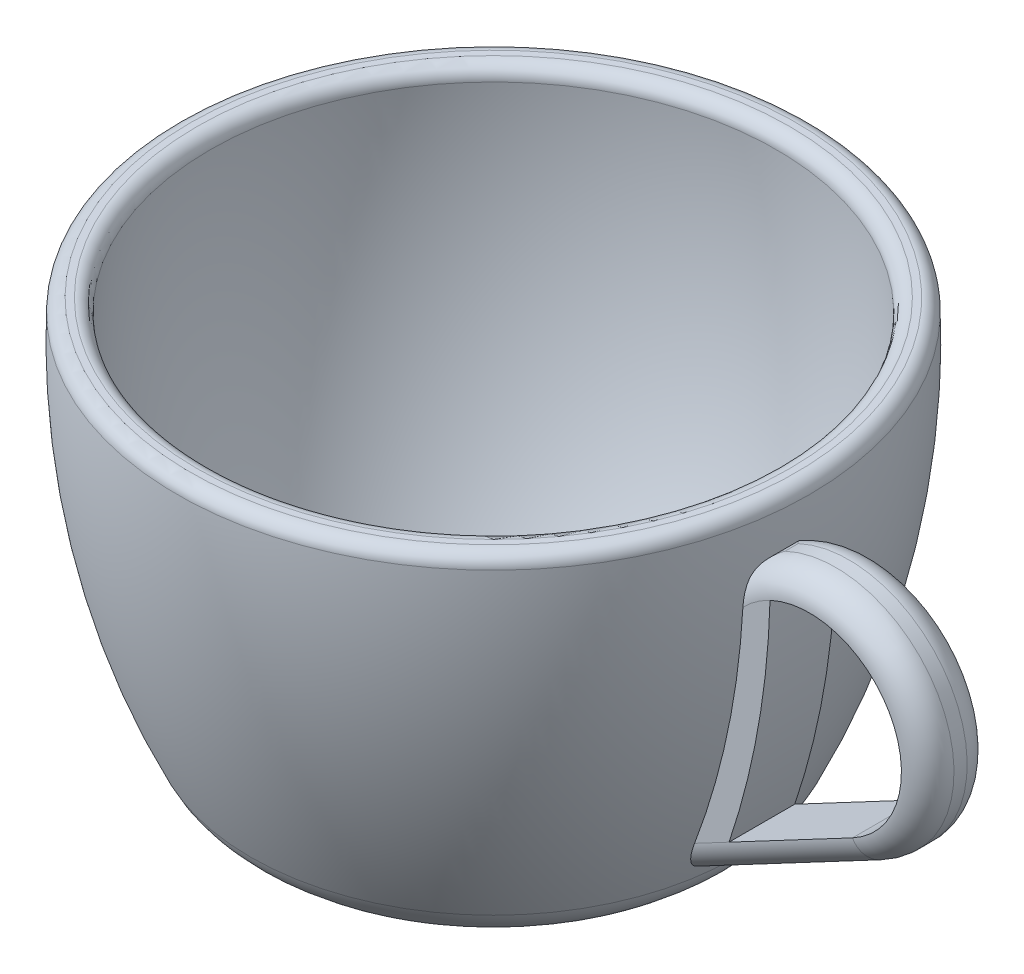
SolidWorks part; units mm, degrees
ref_plane "Alzado" through (0, 0, 0) normal (0, 0, 1) x (1, 0, 0)
ref_plane "Planta" through (0, 0, 0) normal (0, 1, 0) x (1, 0, 0)
ref_plane "Vista lateral" through (0, 0, 0) normal (1, 0, 0) x (0, 0, -1)
sketch "Croquis3" plane through (0, 0, 0) normal (0, 0, 1) x (1, 0, 0)
  line L0 (0, -15.25) -> (0, 15.25)
  line L1 (0, 15.25) -> (24, 15.25)
  line L2 (0, -15.25) -> (17, -15.25)
  arc A0 (24, 15.25) -> (17, -15.25) centre (-33.9344, 12.4932) cw
  point P3 (0, 0)
  dimension "D4" = 58
  dimension "D1" = 30.5
  dimension "D2" = 24
  dimension "D3" = 17
revolve "Revolución1" add sketch "Croquis3" angle 360 about L0
sketch "Croquis6" plane through (0, 15.25, 0) normal (0, 1, 0) x (1, 0, 0)
  circle A0 centre (0, 0) radius 21.5
  dimension "D1" = 43
extrude "Saliente-Extruir1" add sketch "Croquis6" against normal blind 0.1
shell "Vaciado2" thickness 2.5
fillet "Redondeo2" radius 1 2 edges at (24, 15.25, 0) (-21.497, 15.25, 0)
sketch "Croquis10" plane through (0, -12.75, 0) normal (0, 1, 0) x (1, 0, 0)
fillet "Redondeo3" radius 5 1 edges at (17, -15.25, 0)
sketch "Croquis15" plane through (0, 0, 0) normal (0, 0, 1) x (1, 0, 0)
  line L0 (19.118, -10.9468) -> (33.2542, -3.4522)
  line L1 (22.9248, -6.6649) -> (32.3174, -1.6852)
  arc A0 (24.0635, 11.9993) -> (33.2542, -3.4522) centre (29.0385, 4.4994) cw
  arc A1 (18.454, -12.3956) -> (24.038, 14.2808) centre (-33.9344, 12.4932) ccw construction
  arc A2 (24.038, 14.2808) -> (23.0385, 15.25) centre (23.0385, 14.25) ccw construction
  arc A3 (24.0635, 11.9993) -> (19.118, -10.9468) centre (-33.9344, 12.4932) cw
  arc A4 (26.0424, 10.8258) -> (32.3174, -1.6852) centre (29.0385, 4.4994) cw
  arc A5 (26.0424, 10.8258) -> (22.9248, -6.6649) centre (-33.9344, 12.4932) cw
  dimension "D1" = 9
  dimension "D4" = 2
  dimension "D2" = 6
  dimension "D3" = 16
extrude "Saliente-Extruir2" add sketch "Croquis15" along normal blind 5 separate body
fillet "Redondeo4" radius 2 5 edges at (26.1861, -7.1995, 5) (26.1861, -7.1995, 0) (36.7736, 9.1003, 5) (24.0635, 11.9993, 2.5) (36.7736, 9.1003, 0)
